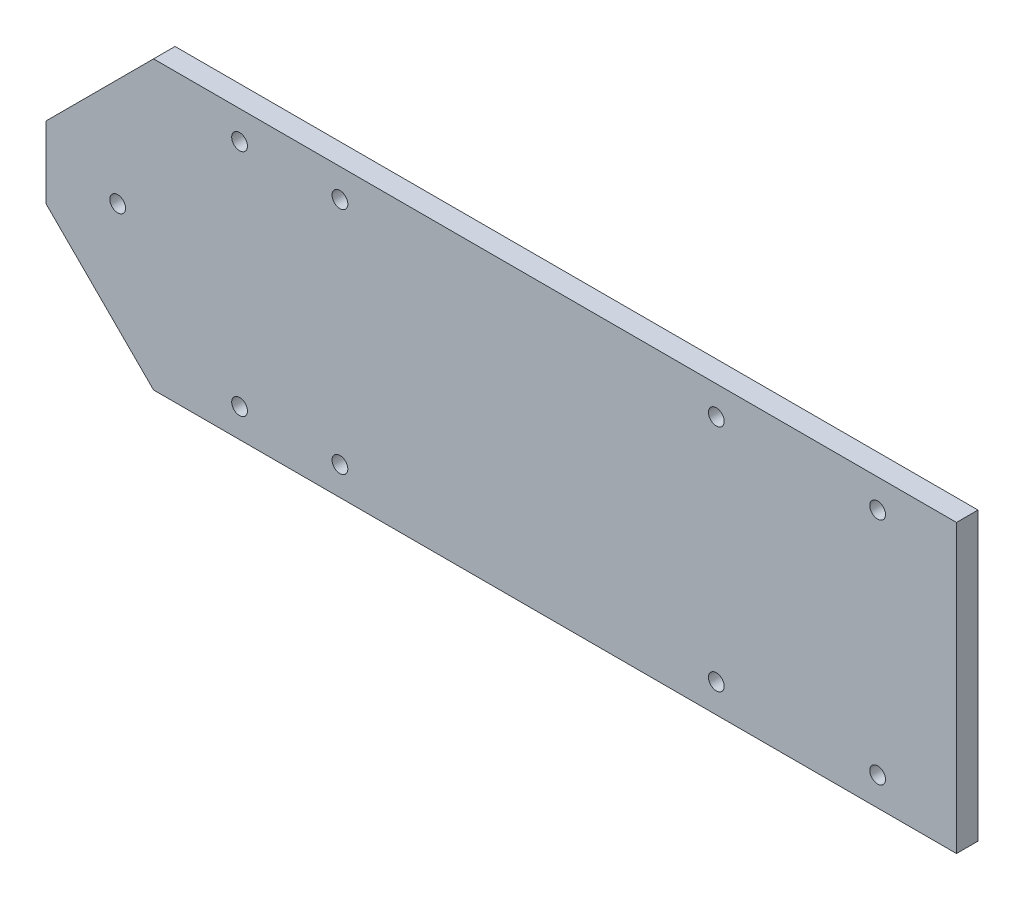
SolidWorks part; units mm, degrees
ref_plane "Face" through (0, 0, 0) normal (0, 0, 1) x (1, 0, 0)
ref_plane "Dessus" through (0, 0, 0) normal (0, 1, 0) x (1, 0, 0)
ref_plane "Droite" through (0, 0, 0) normal (1, 0, 0) x (0, 0, -1)
sketch "Esquisse1" plane through (0, 0, 0) normal (0, 0, 1) x (1, 0, 0)
  line L0 (-172.572, 0) -> (10.509, 0) construction
  line L1 (0, 34.4696) -> (0, -31.6672) construction
  line L2 (-172.572, 20) -> (24.5211, 20) construction
  line L3 (-165, 31.387) -> (-165, -35.3103) construction
  line L4 (-165, -5) -> (-165, 5)
  line L5 (-150, 20) -> (-38, 20)
  line L6 (-38, 20) -> (-38, -20)
  line L7 (-165, 5) -> (-150, 20)
  line L8 (-165, -5) -> (-150, -20)
  line L9 (-150, -20) -> (-38, -20)
  point P8 (-165, -20)
  point P9 (-165, 20)
  point P11 (-165, 0)
  point P17 (-38, 0)
  dimension "D3" = 15
  dimension "D1" = 15
  dimension "D2" = 15
  dimension "D4" = 40
  dimension "D5" = 127
extrude "Base-Extrusion" add sketch "Esquisse1" along normal blind 3
sketch "Esquisse2" plane through (0, 0, 3) normal (0, 0, 1) x (1, 0, 0)
  line L0 (-152.8116, 0) -> (-33.8043, 0) construction
  line L1 (-124, 8.3779) -> (-124, 55.8202) construction
  line L2 (-138, 26.7586) -> (-138, -36.3064) construction
  line L3 (-180.5335, -16) -> (-33.8043, -16) construction
  line L4 (-166.5895, 16) -> (-33.8043, 16) construction
  line L5 (-38, 20) -> (-150, 20) construction
  line L6 (-38, -20) -> (-38, 20) construction
  line L7 (-49, 22.8017) -> (-49, -26.8472) construction
  line L8 (-70.9126, 21.3307) -> (-70.9126, -28.3183) construction
  line L9 (-165, 5) -> (-165, -5) construction
  line L10 (-150, -20) -> (-38, -20) construction
  circle A0 centre (-155, 0) radius 1.1
  circle A2 centre (-138, 16) radius 1.1
  circle A3 centre (-124, 16) radius 1.1
  circle A4 centre (-71.5, 16) radius 1.1
  circle A5 centre (-49, 16) radius 1.1
  circle A8 centre (-49, -16) radius 1.1
  circle A9 centre (-71.5, -16) radius 1.1
  circle A10 centre (-124, -16) radius 1.1
  circle A11 centre (-138, -16) radius 1.1
  dimension "D1" = 2.2
  dimension "D3" = 4
  dimension "D4" = 12
  dimension "D5" = 22.5
  dimension "D2" = 11
  dimension "D7" = 10
  dimension "D8" = 14
extrude "Enlèv. mat.-Extru.1" cut sketch "Esquisse2" against normal through all
